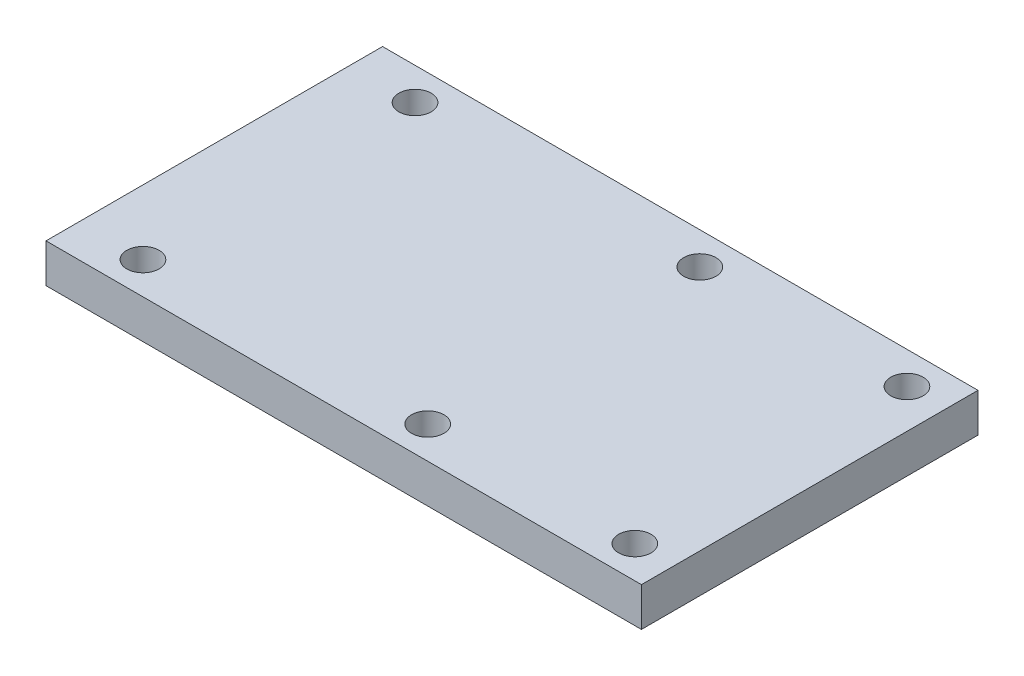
SolidWorks part; units mm, degrees
ref_plane "Front Plane" through (0, 0, 0) normal (0, 0, 1) x (1, 0, 0)
ref_plane "Top Plane" through (0, 0, 0) normal (0, 1, 0) x (1, 0, 0)
ref_plane "Right Plane" through (0, 0, 0) normal (1, 0, 0) x (0, 0, -1)
sketch "Sketch1" plane through (0, 0, 0) normal (0, 1, 0) x (1, 0, 0)
  line L1 (-100, -60) -> (60, -60)
  line L2 (-100, -60) -> (-100, 70)
  line L3 (-100, 70) -> (60, 70)
  line L4 (60, -60) -> (60, 70)
  line L5 (-100, -60) -> (-52.5, -31.5) construction
  line L14 (0, 0) -> (52.5, 31.5) construction
  point P0 (0, 0)
  point P6 (0, 0)
  dimension "D1" = 160
  dimension "D2" = 130
extrude "Boss-Extrude1" add sketch "Sketch1" along normal blind 15
sketch "Sketch2" plane through (0, 15, 0) normal (0, 1, 0) x (1, 0, 0)
  line L0 (-100, 70) -> (60, -60) construction
  line L2 (-75, -47.55) -> (35, -47.55) construction
  line L3 (-75, -47.55) -> (-75, 57.55) construction
  line L4 (-75, 57.55) -> (35, 57.55) construction
  line L5 (35, -47.55) -> (35, 57.55) construction
  line L6 (-75, -47.55) -> (35, 57.55) construction
  line L7 (-75, 57.55) -> (35, -47.55) construction
  circle A0 centre (-75, 57.55) radius 6.25
  circle A1 centre (35, 57.55) radius 6.25
  circle A2 centre (-75, -47.55) radius 6.25
  circle A3 centre (35, -47.55) radius 6.25
  point P2 (-20, 5)
  dimension "D3" = 12.5
  dimension "D1" = 105.1
  dimension "D2" = 110
extrude "Cut-Extrude1" cut sketch "Sketch2" against normal blind 10
sketch "Sketch5" plane through (0, 15, 0) normal (0, 1, 0) x (1, 0, 0)
  circle A0 centre (-75, 57.55) radius 4
  circle A1 centre (35, 57.55) radius 4
  circle A2 centre (-75, -47.55) radius 4
  circle A3 centre (35, -47.55) radius 4
  dimension "D1" = 8
extrude "Cut-Extrude2" cut sketch "Sketch5" against normal blind 48
sketch "Sketch6" plane through (60, 0, 0) normal (1, 0, 0) x (0, 0, -1)
  line L4 (-60, 0) -> (70, 0)
  line L5 (70, 0) -> (70, 15)
  line L6 (70, 15) -> (-60, 15)
  line L7 (-60, 15) -> (-60, 0)
  line L8 (-60, 0) -> (70, 0)
  line L9 (70, 0) -> (70, 15)
  line L10 (70, 15) -> (-60, 15)
  line L11 (-60, 15) -> (-60, 0)
  dimension "D1" = 0
extrude "Boss-Extrude2" add sketch "Sketch6" along normal blind 70
sketch "Sketch8" plane through (0, 15, 0) normal (0, 1, 0) x (1, 0, 0)
  line L0 (35, 57.55) -> (39, 57.55)
  line L1 (130, 57.55) -> (39, 57.55) construction
  line L2 (130, 70) -> (130, -60) construction
  line L3 (35, -47.55) -> (130, -47.55) construction
  circle A0 centre (35, 57.55) radius 4 construction
  circle A1 centre (115, 57.55) radius 6.25
  circle A2 centre (115, -47.55) radius 6.25
  dimension "D1" = 12.5
  dimension "D2" = 12.5
  dimension "D3" = 80
  dimension "D4" = 80
extrude "Cut-Extrude3" cut sketch "Sketch8" against normal blind 10 contours A1 | A2
sketch "Sketch9" plane through (0, 15, 0) normal (0, 1, 0) x (1, 0, 0)
  circle A0 centre (115, 57.55) radius 4
  circle A1 centre (115, -47.55) radius 4
  dimension "D1" = 8
  dimension "D2" = 8
extrude "Cut-Extrude6" cut sketch "Sketch9" against normal blind 15
